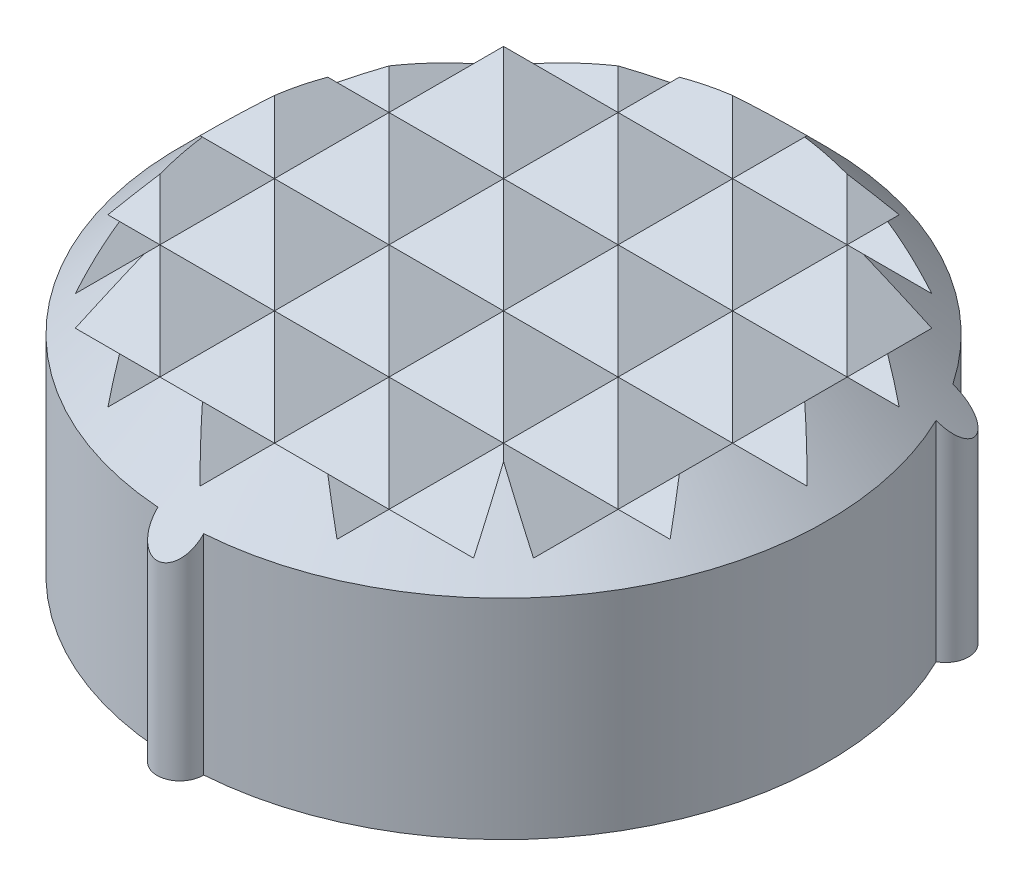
SolidWorks part; units mm, degrees
ref_plane "Front Plane" through (0, 0, 0) normal (0, 0, 1) x (1, 0, 0)
ref_plane "Top Plane" through (0, 0, 0) normal (0, 1, 0) x (1, 0, 0)
ref_plane "Right Plane" through (0, 0, 0) normal (1, 0, 0) x (0, 0, -1)
sketch "Sketch1" plane through (0, 0, 0) normal (0, 0, 1) x (1, 0, 0)
  line L0 (0, 0) -> (0, -66.2626) construction
  line L1 (0, 0) -> (6.05, 0)
  line L2 (6.05, 0) -> (6.05, 5)
  line L4 (6.05, 5) -> (0, 5)
  line L5 (0, 5) -> (0, 0)
  dimension "D1" = 5
  dimension "D2" = 12.1
revolve "Revolve1" add sketch "Sketch1" angle 360 about L0
sketch "Sketch2" plane through (0, 0, 0) normal (0, 1, 0) x (1, 0, 0)
  line L0 (0, 0) -> (0, -5.5148) construction
  line L1 (0, 0) -> (-5.4284, 3.1341) construction
  line L2 (0, 0) -> (5.592, 3.2286) construction
  arc A0 (0.3997, -5.6358) -> (5.0807, 2.4717) centre (0, 0) ccw
  circle A1 centre (0, 0) radius 6.55
  arc A3 (-0.3997, -5.6358) -> (0.3997, -5.6358) centre (0, -5.65) ccw
  arc A4 (-4.6809, 3.1641) -> (-5.0807, 2.4717) centre (-4.893, 2.825) ccw
  arc A5 (-5.0807, 2.4717) -> (-0.3997, -5.6358) centre (0, 0) ccw
  arc A6 (5.0807, 2.4717) -> (4.6809, 3.1641) centre (4.893, 2.825) ccw
  arc A7 (4.6809, 3.1641) -> (-4.6809, 3.1641) centre (0, 0) ccw
  circle A8 centre (0, 0) radius 6.05 construction
  dimension "D1" = 11.3
  dimension "D2" = 0.5
  dimension "D3" = 120
  dimension "D4" = 120
extrude "Extrude1" cut sketch "Sketch2" along normal through all
sketch "Sketch4" plane through (0, 0, 0) normal (0, 1, 0) x (1, 0, 0)
  line L0 (0, 0) -> (4.9919, 0) construction
  line L1 (0, 0) -> (3.8331, -3.8331) construction
  dimension "D1" = 45
ref_plane "Plane1" through (0, 0, 0) normal (0.7071, 0, 0.7071) x (0.7071, 0, -0.7071)
sketch "Sketch6" plane through (0, 0, 0) normal (1, 0, 0) x (0, 0, -1)
  line L0 (0, 0) -> (0, 4.8917) construction
  line L2 (-8.3, 1) -> (-8.3, 5)
  line L3 (-8.3, 5) -> (-4.3, 5)
  line L4 (-4.3, 5) -> (-8.3, 1)
  point P5 (-5.3, 4)
  dimension "D1" = 5
  dimension "D2" = 10.6
  dimension "D3" = 45
  dimension "D4" = 1
  dimension "D5" = 1
revolve "Cut-Revolve1" cut sketch "Sketch6" angle 360 about L0
sketch "Sketch5" plane through (0, 0, 0) normal (0, 0, 1) x (1, 0, 0)
  line L0 (1, 5) -> (0, 4)
  line L2 (0, 4) -> (-1, 5)
  line L3 (-1, 5) -> (1, 5)
  line L4 (0, 4) -> (0, 5) construction
  line L5 (-0.3997, 5) -> (-5.65, 5) construction
  dimension "D1" = 2
extrude "Extrude2" cut sketch "Sketch5" against normal through all and the other way through all
pattern_linear "LPattern1" count 8 spacing 2 along (-1, 0, 0) count 8 spacing 2 along (1, 0, 0) of "Extrude2"
mirror "Mirror1" about plane through (0, 0, 0) normal (0.7071, 0, 0.7071) of "LPattern1", "Extrude2"
sketch "Sketch7" [suppressed] plane through (0, 0, 0) normal (0, 1, 0) x (1, 0, 0)
  line L1 (-0.8, 0.8) -> (0.8, 0.8)
  line L2 (-0.8, 0.8) -> (-0.8, -0.8)
  line L3 (-0.8, -0.8) -> (0.8, -0.8)
  line L4 (0.8, 0.8) -> (0.8, -0.8)
  line L5 (-0.8, 0.8) -> (0.8, -0.8) construction
  line L6 (-0.8, -0.8) -> (0.8, 0.8) construction
  point P0 (0, 0)
  dimension "D1" = 1.6
extrude "Extrude3" [suppressed] add sketch "Sketch7" along normal blind 5.8
draft "Draft1" [suppressed] type of draft neutral plane draft angle 45 faces to draft 4 parameters "D1"=45
sketch "Sketch8" [suppressed] plane through (0, 0, 0) normal (0, 0, 1) x (1, 0, 0)
  line L0 (0, 0) -> (0, 4.8917) construction
  line L2 (-7.15, 1) -> (-7.15, 5)
  line L3 (-7.15, 5) -> (-3.15, 5)
  line L4 (-3.15, 5) -> (-7.15, 1)
  dimension "D1" = 5
  dimension "D2" = 10.6
  dimension "D3" = 45
  dimension "D4" = 1
revolve "Cut-Revolve3" [suppressed] cut sketch "Sketch8" angle 360 about L0
